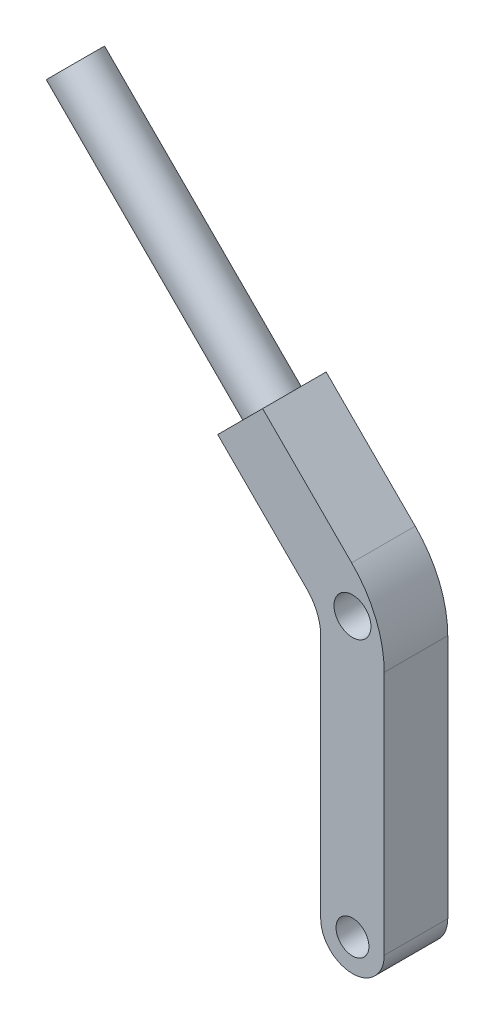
SolidWorks part; units mm, degrees
ref_plane "Front Plane" through (0, 0, 0) normal (0, 0, 1) x (1, 0, 0)
ref_plane "Top Plane" through (0, 0, 0) normal (0, 1, 0) x (1, 0, 0)
ref_plane "Right Plane" through (0, 0, 0) normal (1, 0, 0) x (0, 0, -1)
sketch "Sketch1" plane through (0, 0, 0) normal (0, 0, 1) x (1, 0, 0)
  line L0 (-5.8579, 5.8579) -> (-28.2843, 28.2843) construction
  line L1 (0, -8.2843) -> (0, -70) construction
  line L6 (8, -8.2843) -> (8, -70)
  line L7 (-0.201, 11.5147) -> (-22.6274, 33.9411)
  line L8 (-8, -8.2843) -> (-8, -70)
  line L9 (-11.5147, 0.201) -> (-33.9411, 22.6274)
  line L10 (-33.9411, 22.6274) -> (-22.6274, 33.9411)
  arc A2 (-5.8579, 5.8579) -> (0, -8.2843) centre (-20, -8.2843) cw construction
  arc A3 (-0.201, 11.5147) -> (8, -8.2843) centre (-20, -8.2843) cw
  arc A4 (-11.5147, 0.201) -> (-8, -8.2843) centre (-20, -8.2843) cw
  arc A5 (8, -70) -> (-8, -70) centre (0, -70) cw
  circle A8 centre (0, -70) radius 4.1368
  circle A9 centre (0, 0) radius 4.6527
  point P6 (0, 0)
  dimension "D4" = 20
  dimension "D1" = 70
  dimension "D2" = 45
  dimension "D3" = 40
  dimension "D5" = 8
  dimension "D6" = 8
extrude "Boss-Extrude1" add sketch "Sketch1" along normal mid plane 16
sketch "Sketch2" plane through (-28.2843, 28.2843, 0) normal (-0.7071, 0.7071, 0) x (0, 0, 1)
  line L0 (8, -8) -> (-8, -8) construction
  line L1 (-8, 8) -> (-8, -8) construction
  circle A0 centre (0, 0) radius 6
  point P5 (0, -8)
  point P8 (-8, 0)
  dimension "D1" = 12
extrude "Boss-Extrude2" add sketch "Sketch2" along normal blind 70
